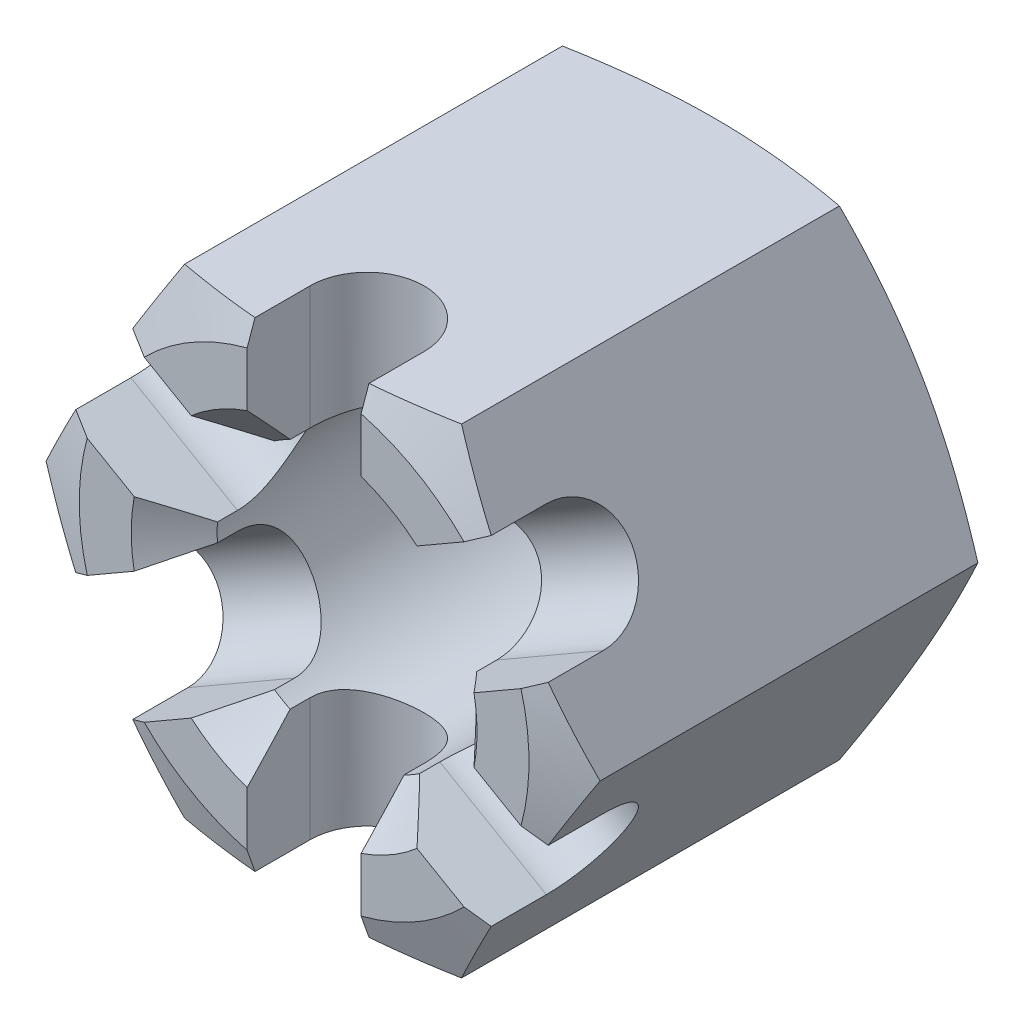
SolidWorks part; units mm, degrees
ref_plane "Front" through (0, 0, 0) normal (0, 0, 1) x (1, 0, 0)
ref_plane "Top" through (0, 0, 0) normal (0, 1, 0) x (1, 0, 0)
ref_plane "Right" through (0, 0, 0) normal (1, 0, 0) x (0, 0, -1)
sketch "Sketch1" plane through (0, 0, 0) normal (0, 0, 1) x (1, 0, 0)
  line L1 (6.9282, -12) -> (13.8564, 0)
  line L2 (13.8564, 0) -> (6.9282, 12)
  line L3 (6.9282, 12) -> (-6.9282, 12)
  line L4 (-6.9282, 12) -> (-13.8564, 0)
  line L5 (-13.8564, 0) -> (-6.9282, -12)
  line L6 (-6.9282, -12) -> (6.9282, -12)
  circle A0 centre (0, 0) radius 12 construction
  dimension "s" = 24
extrude "BaseNut" add sketch "Sketch1" against normal blind 20.8
sketch "Sketch2" plane through (-3.4718, 0, -17.3282) normal (0, 1, 0) x (0, 0, -1)
  line L0 (3.4718, 7.7782) -> (2.5231, 10.3846)
  line L3 (2.5231, 10.3846) -> (3.4718, 10.3846)
  line L4 (3.4718, 10.3846) -> (3.4718, 7.7782)
  line L5 (0, -3.4718) -> (-12.6262, -3.4718) construction
  line L6 (-17.3282, 7.7782) -> (-17.3282, 10.3846)
  line L8 (-17.3282, 10.3846) -> (-16.3795, 10.3846)
  line L9 (-16.3795, 10.3846) -> (-17.3282, 7.7782)
  dimension "dw" = 22.5
  dimension "D2" = 20
  dimension "D3" = 20
revolve "Double-Chamfer" cut sketch "Sketch2" angle 360 about L5
sketch "Sketch3" plane through (-4.2799, -1.7357, -20.8) normal (0, 0, -1) x (-1, 0, 0)
  line L0 (-4.2799, 1.7357) -> (-4.2799, 3.2357) construction
  circle A0 centre (-4.2799, 1.7357) radius 6.5
  circle A1 centre (-4.2799, 1.7357) radius 11.25 construction
  dimension "D1" = 13
  dimension "D2" = 1.5
extrude "Hole" cut sketch "Sketch3" against normal through all
sketch "Sketch4" plane through (-15.7583, 0, -7.1083) normal (0, 1, 0) x (0, 0, -1)
  line L0 (13.6917, -24.4083) -> (11.5417, -22.2583)
  line L2 (11.5417, -22.2583) -> (13.6917, -22.2583)
  line L3 (13.6917, -22.2583) -> (13.6917, -24.4083)
  line L4 (0, -15.7583) -> (-22.8666, -15.7583) construction
  line L7 (-7.1083, -22.2583) -> (-4.9583, -22.2583)
  line L9 (-4.9583, -22.2583) -> (-7.1083, -24.4083)
  line L10 (-7.1083, -24.4083) -> (-7.1083, -22.2583)
  dimension "D1" = 17.3
  dimension "D2" = 45
  dimension "D3" = 45
revolve "EndChamfer" cut sketch "Sketch4" angle 360 about L4
sketch "Sketch5" plane through (-17.8, 0, -17.8) normal (0, 1, 0) x (0, 0, -1)
  line L0 (-17.8, -14.95) -> (-14.65, -14.95)
  line L2 (-14.65, -20.65) -> (-17.8, -20.65)
  line L3 (-17.8, -20.65) -> (-17.8, -14.95)
  line L6 (3, -26.45) -> (3, -9.15) construction
  line L8 (-17.8, -9.15) -> (-17.8, -26.45) construction
  arc A0 (-14.65, -14.95) -> (-14.65, -20.65) centre (-14.65, -17.8) cw
  point P2 (-11.8, -17.8)
  point P3 (3, -17.8)
  dimension "n" = 5.7
  dimension "W" = 14.8
extrude "Slot" cut sketch "Sketch5" against normal through all
pattern_circular "SlotPattern" count 6 over 360 about axis through (0, 0, 0) along (0, 0, 1) of "Slot"
sketch "Sketch6" plane through (-3.4767, 0, -17.3331) normal (0, 1, 0) x (0, 0, -1)
  line L0 (-17.3331, 0.5233) -> (-11.3331, 0.5233)
  line L1 (-11.3331, 0.5233) -> (-7.7457, 10.3797)
  line L2 (-7.7457, 10.3797) -> (-17.3331, 10.3797)
  line L3 (-17.3331, 10.3797) -> (-17.3331, 0.5233)
  line L7 (0, -3.4767) -> (-20.8098, -3.4767) construction
  line L8 (-17.3331, 7.7733) -> (-17.3331, 7.3733) construction
  line L9 (2.5182, 10.3797) -> (-16.3844, 10.3797) construction
  dimension "D1" = 70
  dimension "D2" = 14.8
  dimension "D3" = 8
revolve "Cut-Revolve1" [suppressed] cut sketch "Sketch6" angle 360 about L7
sketch "Sketch7" plane through (0, 0, 0) normal (0, 1, 0) x (1, 0, 0)
  line L0 (5, 19.4) -> (6.5, 19.4)
  line L1 (6.5, 19.4) -> (7.799, 18.65)
  line L2 (7.799, 18.65) -> (6.5, 17.9)
  line L3 (6.5, 17.9) -> (5, 17.9)
  line L4 (5, 17.9) -> (5, 19.4)
  line L5 (0, 25.358) -> (0, -3.8405) construction
  line L6 (-6.5, 18.65) -> (6.5, 18.65) construction
  dimension "D1" = 1.5
  dimension "D2" = 13
revolve "Cut-Revolve10" [suppressed] cut sketch "Sketch7" angle 360 about L5
pattern_linear "LPattern10" [suppressed] count 10 spacing 1.8 along (0, 0, 1)
equation "\"D2@Sketch6\" = \"W@Sketch5\""
equation "\"D1@Sketch3\" = \"D2@ThreadCosmetic1\" - \"D2@Sketch3\" * 2"
equation "\"D2@Sketch7\" = \"D1@Sketch3\""
equation "\"D1@Sketch7\" = (  \"D2@ThreadCosmetic1\" - \"D1@Sketch3\" )  / 2"
equation "\"D3@LPattern10\" = \"D1@Sketch7\" * 1.2"
equation "\"D1@LPattern10\" = \"m@BaseNut\"  / \"D3@LPattern10\" - 2"
